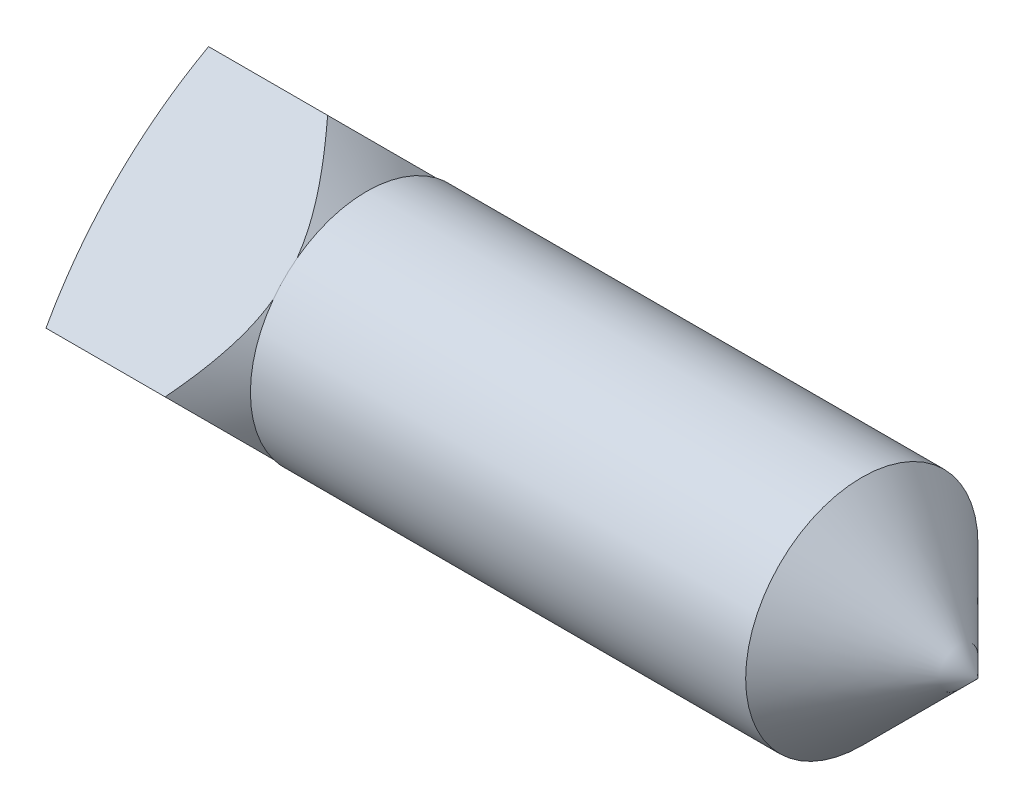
SolidWorks part; units mm, degrees
ref_plane "Plane1" through (0, 0, 0) normal (0, 0, 1) x (1, 0, 0)
ref_plane "Plane2" through (0, 0, 0) normal (0, 1, 0) x (1, 0, 0)
ref_plane "Plane3" through (0, 0, 0) normal (1, 0, 0) x (0, 0, -1)
sketch "BodySke" plane through (0, 0, 0) normal (0, 0, 1) x (1, 0, 0)
  line L0 (2.5522, -2.413) -> (10.287, -2.413) construction
  line L1 (0, 0) -> (0, 2.413)
  line L2 (0, 2.413) -> (10.287, 2.413)
  line L3 (10.287, 2.413) -> (12.7, 0)
  line L4 (12.7, 0) -> (0, 0)
  line L5 (-12.7, 0) -> (88.9, 0) construction
  line L6 (10.287, -2.413) -> (12.7, 0) construction
  line L7 (0.7874, 6.35) -> (0.7874, 0) construction
  line L8 (-2.413, 6.35) -> (-2.413, 0) construction
  dimension "Cone_ang" = 90
  dimension "Length" = 12.7
  dimension "Diameter" = 4.826
  dimension "Advance" = 0.7874
  dimension "Thread_nom" = 12.7
revolve "BaseBody" add sketch "BodySke"
revolve "HeadChamfer1" cut sketch "Sketch6"
sketch "Sketch6"
  line L0 (0, 2.413) -> (-0.8085, 3.3766)
  line L3 (0, 1.9352) -> (0, 3.3766) construction
  line L4 (-3.2823, 3.3766) -> (0, 3.3766) construction
  line L5 (-0.8085, 3.3766) -> (-0.8085, 16.0766)
  line L6 (12.7, 2.413) -> (0, 2.413)
  line L7 (12.7, 2.413) -> (12.7, 16.0766)
  line L8 (12.7, 16.0766) -> (-0.8085, 16.0766)
  line L9 (0, 0) -> (60.325, 0) construction
extrude "BaseHead" add sketch "Sketch4" along normal blind 3.7592
sketch "Sketch4" plane through (0, 0, 0) normal (-1, 0, 0) x (0, -0.7071, 0.7071)
  line L1 (-2.3876, -2.3876) -> (2.3876, -2.3876)
  line L2 (-2.3876, -2.3876) -> (-2.3876, 2.3876)
  line L3 (-2.3876, 2.3876) -> (2.3876, 2.3876)
  line L4 (2.3876, -2.3876) -> (2.3876, 2.3876)
  dimension "D1" = 4.7752
  dimension "Width_flats" = 4.7752
  dimension "D2" = 2.3876
  dimension "D3" = 2.3876
revolve "HeadCrown" cut sketch "Sketch5" angle 360 about L1
sketch "Sketch5" plane through (0, 0, 0) normal (0, 0, 1) x (1, 0, 0)
  line L0 (-3.7592, 0) -> (-16.4592, 0)
  line L1 (0, 0) -> (57.15, 0) construction
  line L2 (-12.7, 0) -> (88.9, 0) construction
  line L3 (-16.4592, 0) -> (-16.4592, 3.3766)
  line L5 (-16.4592, 3.3766) -> (-3.2823, 3.3766)
  line L6 (-3.7592, 3.3766) -> (0, 3.3766) construction
  arc A0 (-3.2823, 3.3766) -> (-3.7592, 0) centre (8.4328, 0) ccw
  dimension "Head_radius" = 12.192
  dimension "D2" = 8.4328
  dimension "D3" = 12.7
sketch "ThdSchSke" plane through (0, 0, 0) normal (0, 0, 1) x (1, 0, 0)
  line L0 (0.7874, -1.9406) -> (0.4566, -2.413)
  line L1 (0.7874, -1.9406) -> (1.1182, -2.413)
  line L2 (1.1182, -2.413) -> (1.1182, -3.0162)
  line L3 (-3.175, 0) -> (5.1513, 0) construction
  line L5 (1.1182, -3.0162) -> (0.4566, -3.0162)
  line L6 (0.4566, -3.0162) -> (0.4566, -2.413)
  dimension "Thread_minor" = 3.8811
  dimension "Diameter" = 4.826
  dimension "Start" = 0.7874
  dimension "SideAngle" = 55
  dimension "VeeAngle" = 70
  dimension "Overcut" = 6.0325
revolve "ThreadSchematic" [suppressed] cut sketch "ThdSchSke" angle 360 about L3
pattern_linear "ThdSchPat" [suppressed]
equation "\"D1@Sketch4\" = \"Width_flats@Sketch4\""
equation "\"D2@Sketch4\" = \"Width_flats@Sketch4\" / 2"
equation "\"D3@Sketch4\" = \"Width_flats@Sketch4\" / 2"
equation "\"D2@Sketch5\" = \"Head_radius@Sketch5\" - \"Head_ht@BaseHead\""
equation "\"Thread_length@ThreadCosmetic\" = ((sgn( (\"Length@BodySke\" - \"Advance@BodySke\" - ( ( \"Diameter@BodySke\" * 0.5 ) / tan( \"Cone_ang@BodySke\" * 0.008726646 ) ) ) - \"Thread_nom@BodySke\" )-1)*( (\"Length@Body"
equation "\"Thread_minor@ThdSchSke\" = \"Thread_minor@ThreadCosmetic\""
equation "\"Diameter@ThdSchSke\" = \"Diameter@BodySke\""
equation "\"Overcut@ThdSchSke\" = \"Diameter@BodySke\" * 1.25"
equation "\"Start@ThdSchSke\" = (\"Length@BodySke\" - ( ( \"Diameter@BodySke\" * 0.5 ) / tan( \"Cone_ang@BodySke\" * 0.008726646 ) ) ) - \"Thread_length@ThreadCosmetic\"  '---Non-countersunk---"
equation "\"Num_threads@ThdSchPat\" = int( \"Thread_length@ThreadCosmetic\" / \"Advance@BodySke\" + 0.999 )  + 1"
equation "\"Advance@ThdSchPat\" = \"Thread_length@ThreadCosmetic\" /  (\"Num_threads@ThdSchPat\" - 1) 'relax it"
equation "' \"Num_threads@ThdSchPat\" = \"Num_threads@ThdSchPat\" - sgn( \"Num_threads@ThdSchPat\" - 1) '---chamfered tips only---"
equation "\"D4@Sketch6\" = \"Diameter@BodySke\" / 2.0"
